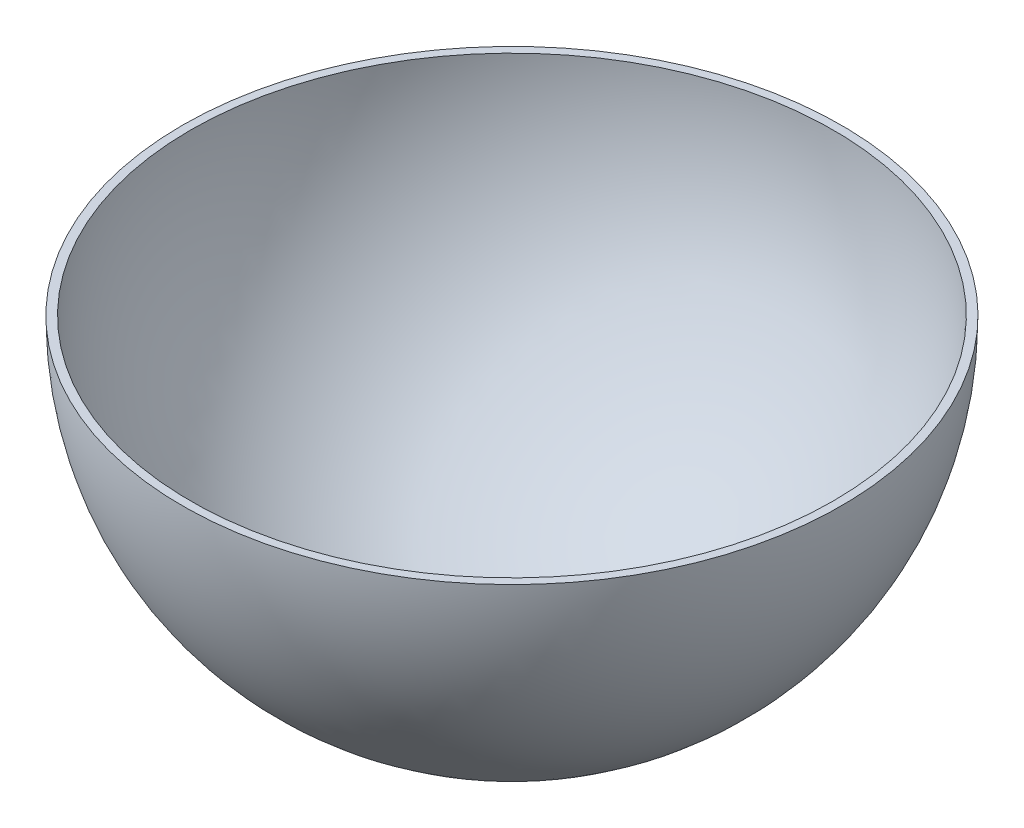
SolidWorks part; units mm, degrees
ref_plane "前视基准面" through (0, 0, 0) normal (0, 0, 1) x (1, 0, 0)
ref_plane "上视基准面" through (0, 0, 0) normal (0, 1, 0) x (1, 0, 0)
ref_plane "右视基准面" through (0, 0, 0) normal (1, 0, 0) x (0, 0, -1)
sketch "半圆草图" plane through (0, 0, 0) normal (0, 0, 1) x (1, 0, 0)
  line L0 (40, 0) -> (-40, 0) construction
  arc A0 (40, 0) -> (-40, 0) centre (0, 0) cw
  point P4 (0, 0)
  point P6 (38.9852, 0)
  point P7 (-38.9496, 0)
  dimension "D1" = 80
revolve "旋转-薄壁" add sketch "半圆草图" angle 180 mid plane about L0
